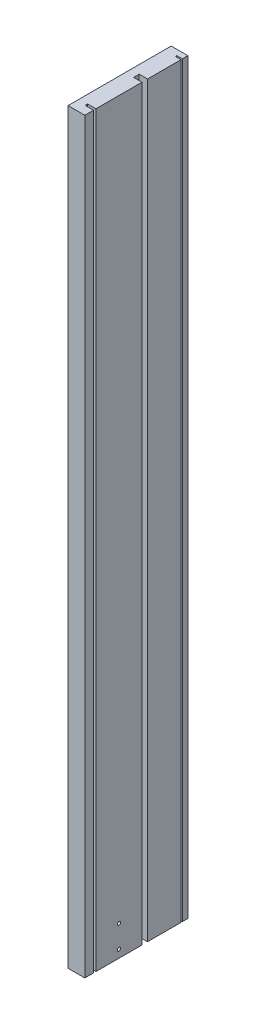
SolidWorks part; units mm, degrees
ref_plane "Front Plane" through (0, 0, 0) normal (0, 0, 1) x (1, 0, 0)
ref_plane "Top Plane" through (0, 0, 0) normal (0, 1, 0) x (1, 0, 0)
ref_plane "Right Plane" through (0, 0, 0) normal (1, 0, 0) x (0, 0, -1)
sketch "Sketch2" plane through (0, 0, 0) normal (1, 0, 0) x (0, 0, -1)
  line L1 (0, 0) -> (234.95, 0)
  line L2 (0, 0) -> (0, 1219.2)
  line L3 (0, 1219.2) -> (234.95, 1219.2)
  line L4 (234.95, 0) -> (234.95, 1219.2)
extrude "Boss-Extrude1" add sketch "Sketch2" along normal mid plane 38.1
sketch "Sketch3" plane through (0, 1219.2, 0) normal (0, 1, 0) x (1, 0, 0)
  line L0 (19.05, 25.4) -> (0, 25.4)
  line L1 (19.05, 19.812) -> (895.35, 19.812) construction
  line L2 (19.05, 234.95) -> (19.05, 0) construction
  line L3 (0, 25.4) -> (0, 19.812)
  line L4 (0, 19.812) -> (19.05, 19.812)
  line L5 (19.05, 25.4) -> (19.05, 19.812)
  line L6 (914.4, 19.812) -> (914.4, 25.4) construction
  line L7 (19.05, 130.175) -> (19.05, 142.875)
  line L8 (19.05, 142.875) -> (0, 142.875)
  line L9 (0, 142.875) -> (0, 130.175)
  line L10 (0, 130.175) -> (19.05, 130.175)
  line L11 (19.05, 222.25) -> (19.05, 219.075)
  line L12 (19.05, 219.075) -> (6.35, 219.075)
  line L13 (6.35, 219.075) -> (6.35, 222.25)
  line L14 (6.35, 222.25) -> (19.05, 222.25)
  dimension "D2" = 12.7
  dimension "D3" = 76.2
  dimension "D4" = 3.175
  dimension "D5" = 12.7
  dimension "D6" = 104.775
  dimension "D7" = 12.7
  dimension "D8" = 19.05
  dimension "D9" = 12.7
extrude "Cut-Extrude1" cut sketch "Sketch3" against normal through all
sketch "Sketch4" plane through (0, 0, 0) normal (0, -1, 0) x (1, 0, 0)
  line L16 (0, -25.4) -> (0, -19.812)
  line L17 (0, -19.812) -> (19.05, -19.812)
  line L18 (19.05, -19.812) -> (19.05, 0)
  line L19 (19.05, 0) -> (-19.05, 0)
  line L20 (-19.05, 0) -> (-19.05, -234.95)
  line L21 (-19.05, -234.95) -> (19.05, -234.95)
  line L22 (19.05, -234.95) -> (19.05, -222.25)
  line L23 (19.05, -222.25) -> (6.35, -222.25)
  line L24 (6.35, -222.25) -> (6.35, -219.075)
  line L25 (6.35, -219.075) -> (19.05, -219.075)
  line L26 (19.05, -219.075) -> (19.05, -142.875)
  line L27 (19.05, -142.875) -> (0, -142.875)
  line L28 (0, -142.875) -> (0, -130.175)
  line L29 (0, -130.175) -> (19.05, -130.175)
  line L30 (19.05, -130.175) -> (19.05, -25.4)
  line L31 (19.05, -25.4) -> (0, -25.4)
  line L32 (0, -25.4) -> (0, -19.812)
  line L33 (0, -19.812) -> (19.05, -19.812)
  line L34 (19.05, -19.812) -> (19.05, 0)
  line L35 (19.05, 0) -> (-19.05, 0)
  line L36 (-19.05, 0) -> (-19.05, -234.95)
  line L37 (-19.05, -234.95) -> (19.05, -234.95)
  line L38 (19.05, -234.95) -> (19.05, -222.25)
  line L39 (19.05, -222.25) -> (6.35, -222.25)
  line L40 (6.35, -222.25) -> (6.35, -219.075)
  line L41 (6.35, -219.075) -> (19.05, -219.075)
  line L42 (19.05, -219.075) -> (19.05, -142.875)
  line L43 (19.05, -142.875) -> (0, -142.875)
  line L44 (0, -142.875) -> (0, -130.175)
  line L45 (0, -130.175) -> (19.05, -130.175)
  line L46 (19.05, -130.175) -> (19.05, -25.4)
  line L47 (19.05, -25.4) -> (0, -25.4)
  dimension "D1" = 0
extrude "Boss-Extrude2" add sketch "Sketch4" along normal offset from surface (482.6 mm away) 304.8
sketch "Sketch5" plane through (-19.05, 0, 0) normal (-1, 0, 0) x (0, 0, 1)
  circle A0 centre (-77.7875, -414.02) radius 3.81 construction
  circle A1 centre (-77.7875, -414.02) radius 3.81
  circle A2 centre (-77.7875, -464.82) radius 3.81 construction
  circle A3 centre (-77.7875, -464.82) radius 3.81
extrude "Cut-Extrude2" cut sketch "Sketch5" against normal through all
equation "\"depth_of_plinko\"= 9.25'wood 2x10"
equation "\"D1@Sketch2\"=\"depth_of_plinko\""
equation "\"Height_of_Plinko\"= 48'plywood sheet 3ftx4ft 3/4in thick"
equation "\"D2@Sketch2\"=\"Height_of_Plinko\""
equation "\"bit_diameter\"=0.5"
equation "\"Pole_area\"=5.5"
